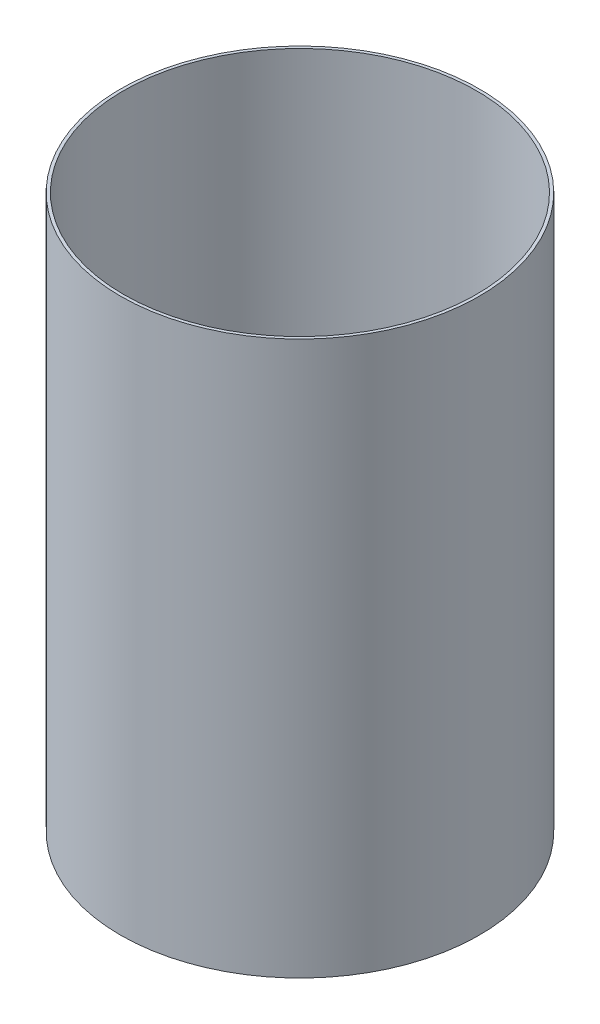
SolidWorks part; units mm, degrees
ref_plane "Face" through (0, 0, 0) normal (0, 0, 1) x (1, 0, 0)
ref_plane "Dessus" through (0, 0, 0) normal (0, 1, 0) x (1, 0, 0)
ref_plane "Droite" through (0, 0, 0) normal (1, 0, 0) x (0, 0, -1)
sketch "Esquisse1" plane through (0, 0, 0) normal (1, 0, 0) x (0, 0, -1)
  line L0 (0, 37.095) -> (0, -23.263) construction
  line L1 (5.9, 17) -> (5.9, 0)
  line L2 (5.9, 0) -> (4, 0)
  line L3 (4, 0) -> (4, -1.5)
  line L4 (4, -1.5) -> (6, -1.5)
  line L5 (6, -1.5) -> (6, 17)
  line L6 (6, 17) -> (5.9, 17)
  dimension "D1" = 0.1
  dimension "D2" = 6
  dimension "D3" = 18.5
  dimension "D4" = 17
  dimension "D5" = 4
revolve "Révolution1" add sketch "Esquisse1" angle 360 about L0
